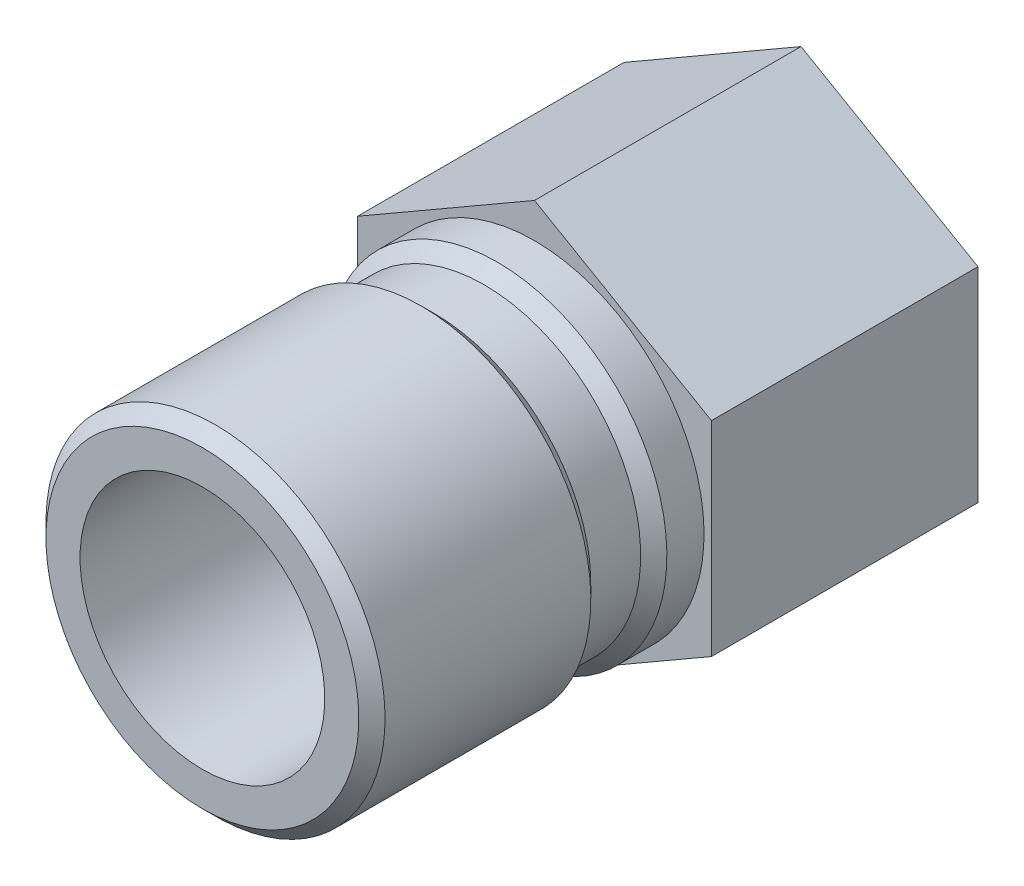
SolidWorks part; units mm, degrees
ref_plane "Front Plane" through (0, 0, 0) normal (0, 0, 1) x (1, 0, 0)
ref_plane "Top Plane" through (0, 0, 0) normal (0, 1, 0) x (1, 0, 0)
ref_plane "Right Plane" through (0, 0, 0) normal (1, 0, 0) x (0, 0, -1)
sketch "Sketch1" plane through (0, 0, 0) normal (1, 0, 0) x (0, 0, -1)
  line L0 (0, 0) -> (-22.479, 0) construction
  line L1 (-19.304, 7.112) -> (-19.304, 9.0932)
  line L2 (-5.8166, 9.0932) -> (-5.8166, 0) construction
  line L3 (-18.542, 9.8552) -> (-6.5786, 9.8552)
  line L4 (0, 12.3864) -> (0, 0) construction
  line L5 (-5.8166, 9.0932) -> (-2.921, 9.0932)
  line L6 (-2.159, 9.8552) -> (0, 9.8552)
  line L7 (0, 9.8552) -> (0, 12.3864)
  line L8 (-5.8166, 9.0932) -> (-6.5786, 9.8552)
  line L9 (-2.921, 9.0932) -> (-2.159, 9.8552)
  line L10 (-19.304, 9.0932) -> (-18.542, 9.8552)
  line L11 (-19.304, 7.112) -> (3.3857, 7.112)
  line L12 (0, 12.3864) -> (15.494, 12.3864)
  line L14 (15.494, 12.3864) -> (15.494, 7.8288)
  line L15 (3.5687, 7.4562) -> (15.494, 7.8288)
  line L16 (3.3857, 7.112) -> (3.5687, 7.4562)
  dimension "D1" = 19.304
  dimension "D2" = 2.8956
  dimension "D3" = 0.762
  dimension "D4" = 45
  dimension "D5" = 13.4874
  dimension "D6" = 45
  dimension "D7" = 24.7728
  dimension "D8" = 118
  dimension "D9" = 34.798
  dimension "D10" = 3.175
  dimension "D11" = 14.9123
  dimension "D12" = 14.224
  dimension "D13" = 1.79
  dimension "D14" = 19.7104
  dimension "D15" = 11.9253
revolve "Revolve1" add sketch "Sketch1" angle 360 about L0
sketch "Sketch2" plane through (0, 0, 0) normal (0, 0, 1) x (1, 0, 0)
  line L1 (-10.287, 5.9392) -> (-10.287, -5.9392)
  line L2 (-10.287, -5.9392) -> (0, -11.8784)
  line L3 (0, -11.8784) -> (10.287, -5.9392)
  line L4 (10.287, -5.9392) -> (10.287, 5.9392)
  line L5 (10.287, 5.9392) -> (0, 11.8784)
  line L6 (0, 11.8784) -> (-10.287, 5.9392)
  circle A0 centre (0, 0) radius 10.287 construction
  dimension "D1" = 20.574
extrude "Cut-Extrude1" cut sketch "Sketch2" against normal through all flip side to cut
